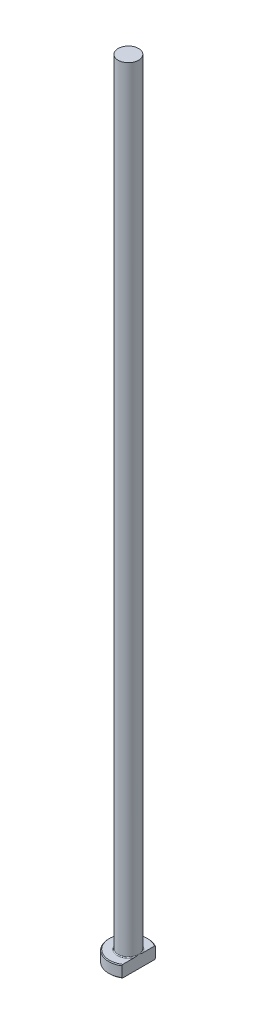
SolidWorks part; units mm, degrees
ref_plane "Front Plane" through (0, 0, 0) normal (0, 0, 1) x (1, 0, 0)
ref_plane "Top Plane" through (0, 0, 0) normal (0, 1, 0) x (1, 0, 0)
ref_plane "Right Plane" through (0, 0, 0) normal (1, 0, 0) x (0, 0, -1)
sketch "Sketch1" plane through (0, 0, 0) normal (0, 0, 1) x (1, 0, 0)
  line L0 (0, 259.9588) -> (0, -15.1925) construction
  line L1 (0, 0) -> (-5, 0)
  line L2 (-5, 0) -> (-5, 3)
  line L3 (-5, 3) -> (-2.6, 3)
  line L4 (-2.6, 3) -> (-2.6, 200)
  line L5 (-2.6, 200) -> (0, 200)
  line L6 (0, 200) -> (0, 0)
  dimension "L" = 200
  dimension "H" = 10
  dimension "T" = 3
  dimension "D" = 5.2
revolve "Revolve1" add sketch "Sketch1" angle 360 about L0
chamfer "Chamfer1" distance 0.2 angle 45 2 edges at (0, 3, 5) (0, 0, 5)
fillet "Fillet1" radius 0.2 1 edges at (0, 3, 2.6)
sketch "Sketch2" plane through (0, 0, 0) normal (0, 1, 0) x (1, 0, 0)
  line L0 (2.6, 4.2708) -> (2.6, -4.2708)
  circle A0 centre (0, 0) radius 5 construction
  arc A1 (2.6, -4.2708) -> (2.6, 4.2708) centre (0, 0) ccw
  circle A2 centre (0, 0) radius 2.6 construction
extrude "KEY" cut sketch "Sketch2" along normal through all
